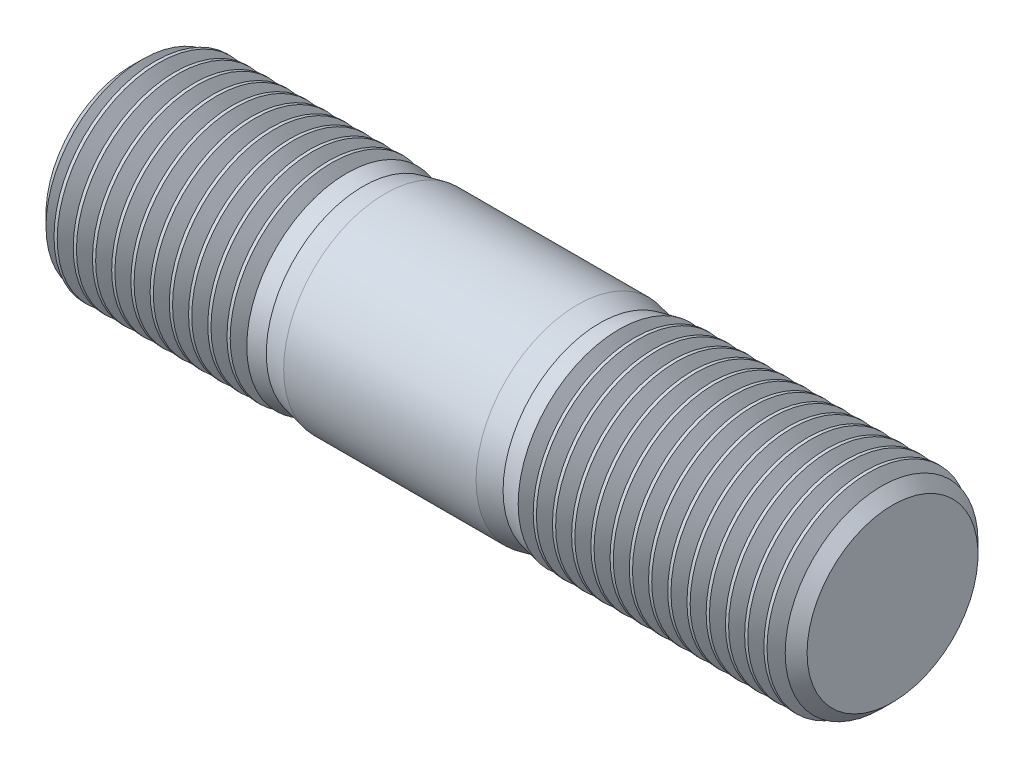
SolidWorks part; units mm, degrees
ref_plane "Front" through (0, 0, 0) normal (0, 0, 1) x (1, 0, 0)
ref_plane "Top" through (0, 0, 0) normal (0, 1, 0) x (1, 0, 0)
ref_plane "Right" through (0, 0, 0) normal (1, 0, 0) x (0, 0, -1)
other "Configuration Table"
sketch "Sketch1" plane through (0, 0, 0) normal (0, 0, 1) x (1, 0, 0)
  line L0 (-1.3108, 0) -> (30.3862, 0) construction
  line L1 (0, 0) -> (0, 6)
  line L2 (0, 6) -> (12.375, 6)
  line L3 (12.375, 6) -> (15, 5.4315)
  line L4 (15, 5.4315) -> (26.375, 5.4315)
  line L5 (26.375, 5.4315) -> (29, 6)
  line L6 (29, 6) -> (45, 6)
  line L7 (45, 6) -> (45, 0)
  line L8 (45, 0) -> (0, 0)
revolve "BaseHead" add sketch "Sketch1" angle 360 about L0
chamfer "HeadChamfer" distance 0.947 angle 45 2 edges at (0, 0, 6) (45, 0, 6)
sketch "Sketch2" plane through (0, 0, 0) normal (0, 0, 1) x (1, 0, 0)
  line L0 (-1.3108, 0) -> (31.2107, 0) construction
  line L1 (29, 6) -> (29, -6) construction
  line L2 (12.375, 5.4315) -> (15, 6)
  line L3 (15, 6) -> (26.375, 6)
  line L4 (26.375, 6) -> (29, 5.4315)
  line L5 (12.375, 6) -> (12.375, -6) construction
  line L9 (12.375, 5.4315) -> (29, 5.4315)
revolve "BaseBody" add sketch "Sketch2" angle 360 about L0
sketch "Sketch3" plane through (0, 0, 0) normal (0, 0, 1) x (1, 0, 0)
  line L0 (44.053, 5.1799) -> (44.5265, 6)
  line L1 (44.5265, 6) -> (44.5265, 6.5)
  line L2 (44.5265, 6.5) -> (43.5795, 6.5)
  line L3 (43.5795, 6.5) -> (43.5795, 6)
  line L4 (43.5795, 6) -> (44.053, 5.1799)
  line L5 (0, 0) -> (46.2373, 0) construction
  line L6 (44.053, 6) -> (44.053, -6) construction
revolve "Cut-Revolve10" cut sketch "Sketch3" angle 360 about L5
pattern_linear "LPattern10" count 14 spacing 1.1364 along (-1, 0, 0) of "Cut-Revolve10"
sketch "Sketch4" plane through (0, 0, 0) normal (0, 0, 1) x (1, 0, 0)
  line L0 (0.947, 5.1799) -> (1.4205, 6)
  line L1 (1.4205, 6) -> (1.4205, 6.5)
  line L2 (1.4205, 6.5) -> (0.4735, 6.5)
  line L3 (0.4735, 6.5) -> (0.4735, 6)
  line L4 (0.4735, 6) -> (0.947, 5.1799)
  line L5 (0, 0) -> (8.4336, 0) construction
  line L6 (0, 5.053) -> (0, -5.053) construction
  line L7 (0.947, 6) -> (0.947, -6) construction
revolve "Cut-Revolve11" cut sketch "Sketch4" angle 360 about L5
pattern_linear "LPattern11" count 11 spacing 1.1364 along (1, 0, 0) of "Cut-Revolve11"
equation "\"D2@Sketch1\" = \"X@Sketch1\""
equation "\"D2@ThreadCosmetic2\" = \"D2@ThreadCosmetic1\""
equation "\"D1@ThreadCosmetic1\" = \"bm@Sketch1\"-\"X@Sketch1\""
equation "\"b@ThreadCosmetic2\" = \"b@Sketch1\""
equation "\"D1@Sketch2\" = \"X@Sketch1\""
equation "\"D2@Sketch2\" = \"d@Sketch1\""
equation "\"D1@HeadChamfer\" =  ( \"d@Sketch1\" - \"D2@ThreadCosmetic1\" )  / 2"
equation "\"D5@Sketch3\" = \"d@Sketch1\""
equation "\"D4@Sketch3\" =  ( \"d@Sketch1\" - \"D2@ThreadCosmetic2\" )  / 2"
equation "\"D3@LPattern10\" = \"D4@Sketch3\" * 1.2"
equation "\"D1@LPattern10\" = \"b@ThreadCosmetic2\" / \"D3@LPattern10\""
equation "\"D5@Sketch4\" = \"d@Sketch1\""
equation "\"D4@Sketch4\" =  ( \"d@Sketch1\" - \"D2@ThreadCosmetic1\" )  / 2"
equation "\"D3@LPattern11\" = \"D4@Sketch4\" * 1.2"
equation "\"D1@LPattern11\" = \"D1@ThreadCosmetic1\" / \"D3@LPattern11\""
